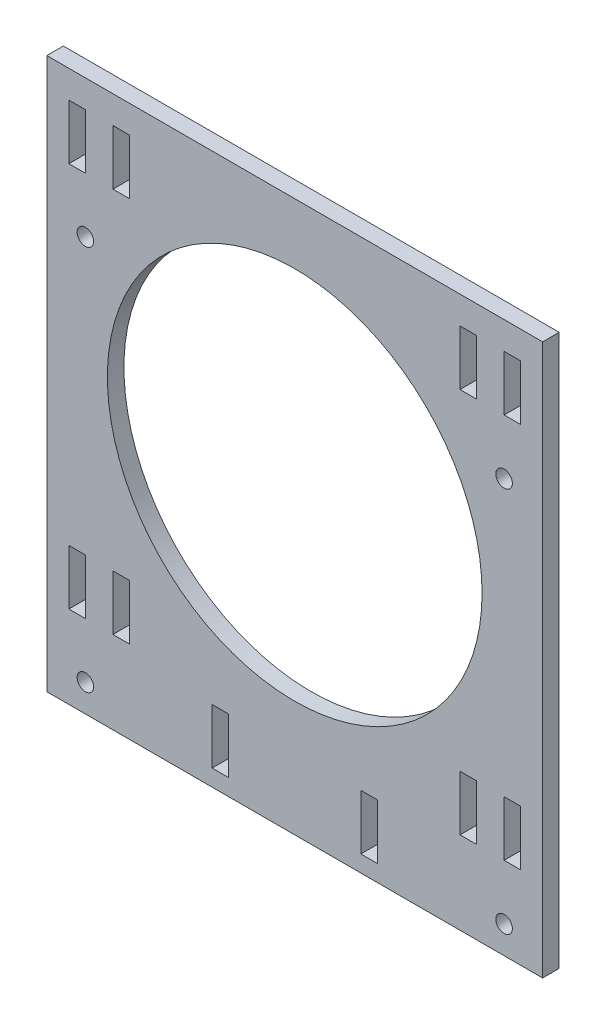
SolidWorks part; units mm, degrees
ref_plane "前视基准面" through (0, 0, 0) normal (0, 0, 1) x (1, 0, 0)
ref_plane "上视基准面" through (0, 0, 0) normal (0, 1, 0) x (1, 0, 0)
ref_plane "右视基准面" through (0, 0, 0) normal (1, 0, 0) x (0, 0, -1)
sketch "草图1" plane through (0, 0, 0) normal (0, 0, 1) x (1, 0, 0)
  line L0 (0, 0) -> (-23.7764, 7.7254) construction
  circle A0 centre (0, 0) radius 12.5
  circle A1 centre (0, 25) radius 12.5
  circle A2 centre (23.7764, 7.7254) radius 12.5
  circle A3 centre (14.6946, -20.2254) radius 12.5
  circle A4 centre (-14.6946, -20.2254) radius 12.5
  circle A5 centre (-23.7764, 7.7254) radius 12.5
  circle A6 centre (-23.7764, 7.7254) radius 10.5
  circle A7 centre (0, 25) radius 10.5
  circle A8 centre (23.7764, 7.7254) radius 10.5
  circle A9 centre (-14.6946, -20.2254) radius 10.5
  circle A10 centre (14.6946, -20.2254) radius 10.5
  circle A11 centre (-23.7764, 7.7254) radius 9
  circle A12 centre (0, 25) radius 9
  circle A13 centre (23.7764, 7.7254) radius 9
  circle A14 centre (14.6946, -20.2254) radius 9
  circle A15 centre (-14.6946, -20.2254) radius 9
  circle A17 centre (0, 0) radius 35.5
  point P16 (0, 0)
  dimension "D1" = 25
  dimension "D2" = 25
  dimension "D4" = 21
  dimension "D5" = 21
  dimension "D6" = 21
  dimension "D7" = 21
  dimension "D8" = 18
  dimension "D11" = 21
  dimension "D3" = 5
  dimension "D10" = 25
  dimension "D9" = 5
sketch "草图2" plane through (0, 0, 0) normal (0, 0, 1) x (1, 0, 0)
  line L0 (-10.5, 25) -> (-10.5, 27.9643)
  line L1 (10.5, 25) -> (10.5, 27.9643)
  line L2 (20.5317, 17.7115) -> (23.3509, 18.6275)
  line L3 (27.0211, -2.2607) -> (29.8403, -1.3447)
  line L4 (23.1893, -14.0537) -> (24.9317, -16.4518)
  line L5 (6.2, -26.3972) -> (7.9423, -28.7953)
  line L6 (-6.2, -26.3972) -> (-7.9423, -28.7953)
  line L7 (-23.1893, -14.0537) -> (-24.9317, -16.4518)
  line L8 (-27.0211, -2.2607) -> (-29.8403, -1.3447)
  line L9 (-20.5317, 17.7115) -> (-23.3509, 18.6275)
  line L11 (0, 0) -> (27.0211, -2.2607) construction
  circle A0 centre (14.6946, -20.2254) radius 10.5 construction
  circle A1 centre (-14.6946, -20.2254) radius 10.5 construction
  circle A2 centre (23.7764, 7.7254) radius 10.5 construction
  circle A3 centre (0, 25) radius 10.5 construction
  circle A4 centre (-23.7764, 7.7254) radius 10.5 construction
  circle A5 centre (0, 0) radius 35.5 construction
  arc A6 (23.1893, -14.0537) -> (6.2, -26.3972) centre (14.6946, -20.2254) ccw
  arc A7 (-6.2, -26.3972) -> (-23.1893, -14.0537) centre (-14.6946, -20.2254) ccw
  arc A8 (20.5317, 17.7115) -> (27.0211, -2.2607) centre (23.7764, 7.7254) ccw
  arc A9 (-10.5, 25) -> (10.5, 25) centre (0, 25) ccw
  arc A10 (-27.0211, -2.2607) -> (-20.5317, 17.7115) centre (-23.7764, 7.7254) ccw
  arc A11 (-16.3413, 31.5153) -> (-24.9231, 25.2802) centre (0, 0) ccw
  arc A12 (-35.0225, -5.8027) -> (-31.7446, -15.8912) centre (0, 0) ccw
  arc A13 (24.9231, 25.2802) -> (16.3413, 31.5153) centre (0, 0) ccw
  arc A14 (31.7446, -15.8912) -> (35.0225, -5.8027) centre (0, 0) ccw
  arc A15 (-5.3039, -35.1016) -> (5.3039, -35.1016) centre (0, 0) ccw
  arc A16 (23.3509, 18.6275) -> (24.9231, 25.2802) centre (22.1148, 22.4318) ccw
  arc A17 (10.5, 27.9643) -> (16.3413, 31.5153) centre (14.5, 27.9643) cw
  arc A18 (-10.5, 27.9643) -> (-16.3413, 31.5153) centre (-14.5, 27.9643) ccw
  arc A19 (-23.3509, 18.6275) -> (-24.9231, 25.2802) centre (-22.1148, 22.4318) cw
  arc A20 (24.9317, -16.4518) -> (31.7446, -15.8912) centre (28.1677, -14.1007) ccw
  arc A21 (7.9423, -28.7953) -> (5.3039, -35.1016) centre (4.7062, -31.1465) cw
  arc A22 (-7.9423, -28.7953) -> (-5.3039, -35.1016) centre (-4.7062, -31.1465) ccw
  arc A23 (-24.9317, -16.4518) -> (-31.7446, -15.8912) centre (-28.1677, -14.1007) cw
  arc A24 (-35.0225, -5.8027) -> (-29.8403, -1.3447) centre (-31.0763, -5.1489) cw
  arc A25 (29.8403, -1.3447) -> (35.0225, -5.8027) centre (31.0763, -5.1489) cw
  dimension "D2" = 4
  dimension "D3" = 4
  dimension "D1" = 5
sketch "草图3" plane through (0, 0, 0) normal (0, 0, 1) x (1, 0, 0)
  line L0 (-45, 45) -> (45, 45)
  line L1 (45, 45) -> (45, -45)
  line L3 (-45, -45) -> (-45, 45)
  line L4 (-45, -45) -> (-45, -55)
  line L7 (-45, -55) -> (45, -55)
  line L8 (45, -45) -> (45, -55)
  circle A16 centre (0, 0) radius 34
  dimension "D4" = 68
  dimension "D1" = 90
  dimension "D2" = 90
  dimension "D3" = 10
extrude "凸台-拉伸2" add sketch "草图3" along normal blind 3
sketch "草图4" plane through (0, 0, 3) normal (0, 0, 1) x (1, 0, 0)
  circle A0 centre (0, 0) radius 13.5
sketch "草图5" plane through (0, 0, 3) normal (0, 0, 1) x (1, 0, 0)
  line L0 (-33, 40) -> (-33, 30)
  line L1 (-33, 30) -> (-30, 30)
  line L2 (-30, 30) -> (-30, 40)
  line L3 (-30, 40) -> (-33, 40)
  line L4 (30, 40) -> (30, 30)
  line L5 (30, 30) -> (33, 30)
  line L6 (33, 30) -> (33, 40)
  line L7 (33, 40) -> (30, 40)
  line L8 (-33, -30) -> (-33, -40)
  line L9 (-33, -40) -> (-30, -40)
  line L10 (-30, -40) -> (-30, -30)
  line L11 (-30, -30) -> (-33, -30)
  line L12 (30, -30) -> (30, -40)
  line L13 (30, -40) -> (33, -40)
  line L14 (33, -40) -> (33, -30)
  line L15 (33, -30) -> (30, -30)
  line L16 (0, 45) -> (0, -54.353) construction
  line L17 (-45, 45) -> (45, 45) construction
  line L18 (-45, 0) -> (45, 0) construction
  line L19 (-45, -55) -> (-45, 45) construction
  line L20 (45, -55) -> (45, 45) construction
  dimension "D1" = 3
  dimension "D2" = 10
  dimension "D3" = 10
  dimension "D4" = 3
  dimension "D5" = 10
  dimension "D6" = 3
  dimension "D7" = 3
  dimension "D8" = 10
  dimension "D9" = 30
  dimension "D10" = 30
  dimension "D11" = 30
  dimension "D12" = 30
  dimension "D13" = 30
  dimension "D14" = 30
  dimension "D15" = 30
  dimension "D16" = 30
extrude "切除-拉伸2" cut sketch "草图5" against normal through all
sketch "草图6" plane through (0, 0, 3) normal (0, 0, 1) x (1, 0, 0)
  line L0 (-38, -30) -> (-38, -40)
  line L1 (-38, -40) -> (-41, -40)
  line L2 (-41, -40) -> (-41, -30)
  line L3 (-41, -30) -> (-38, -30)
  line L4 (-33, -30) -> (-33, -40) construction
  line L5 (-30, -30) -> (-33, -30) construction
  line L6 (-41, 40) -> (-41, 30)
  line L7 (-41, 30) -> (-38, 30)
  line L8 (-38, 30) -> (-38, 40)
  line L9 (-38, 40) -> (-41, 40)
  line L10 (-30, 40) -> (-33, 40) construction
  line L11 (-45, 45) -> (45, 45) construction
  line L16 (-15, -42) -> (-15, -52)
  line L17 (-15, -52) -> (-12, -52)
  line L18 (-12, -52) -> (-12, -42)
  line L19 (-15, -42) -> (-12, -42)
  line L20 (0, 45) -> (0, -55.2023) construction
  line L21 (15, -42) -> (12, -42)
  line L22 (12, -52) -> (12, -42)
  line L23 (15, -52) -> (12, -52)
  line L24 (15, -42) -> (15, -52)
  line L25 (38, 40) -> (41, 40)
  line L26 (38, 30) -> (38, 40)
  line L27 (41, 30) -> (38, 30)
  line L28 (41, 40) -> (41, 30)
  line L29 (41, -30) -> (38, -30)
  line L30 (41, -40) -> (41, -30)
  line L31 (38, -40) -> (41, -40)
  line L32 (38, -30) -> (38, -40)
  line L33 (-45, -55) -> (45, -55) construction
  circle A0 centre (-38, -50) radius 1.5
  circle A1 centre (-38, 20) radius 1.5
  circle A2 centre (38, 20) radius 1.5
  circle A3 centre (38, -50) radius 1.5
  dimension "D7" = 25
  dimension "D8" = 3
  dimension "D9" = 3
  dimension "D10" = 5
  dimension "D1" = 5
  dimension "D2" = 3
  dimension "D3" = 10
  dimension "D4" = 10
  dimension "D5" = 0
  dimension "D6" = 3
  dimension "D11" = 3
  dimension "D12" = 10
  dimension "D13" = 3
  dimension "D14" = 12
extrude "切除-拉伸3" cut sketch "草图6" against normal blind 10
